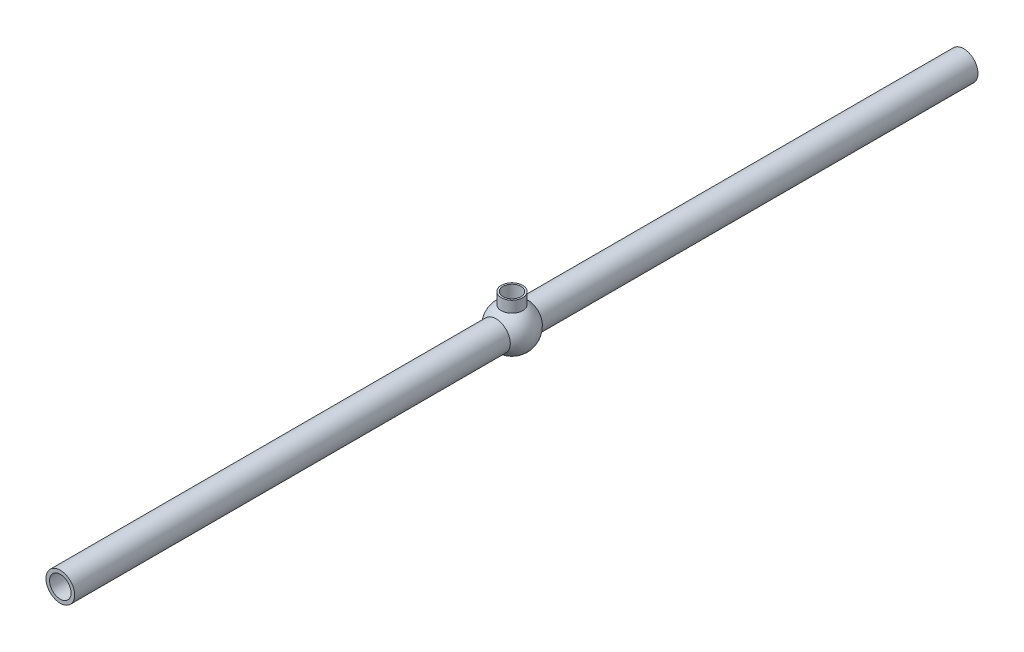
SolidWorks part; units mm, degrees
ref_plane "Front Plane" through (0, 0, 0) normal (0, 0, 1) x (1, 0, 0)
ref_plane "Top Plane" through (0, 0, 0) normal (0, 1, 0) x (1, 0, 0)
ref_plane "Right Plane" through (0, 0, 0) normal (1, 0, 0) x (0, 0, -1)
sketch "Sketch1" plane through (0, 0, 0) normal (0, 0, 1) x (1, 0, 0)
  line L0 (0, 42.0068) -> (0, -30) construction
  line L1 (0, -25) -> (0, -30)
  line L2 (12.5, 21.6506) -> (12.5, 41.6506)
  line L3 (15, 25.9808) -> (15, 41.6506)
  line L4 (15, 41.6506) -> (12.5, 41.6506)
  arc A0 (0, -25) -> (12.5, 21.6506) centre (0, 0) ccw
  arc A1 (0, -30) -> (15, 25.9808) centre (0, 0) ccw
  point P7 (0, 0)
revolve "Revolve1" add sketch "Sketch1" angle 360 about L0
sketch "Sketch2" plane through (0, 0, 0) normal (0, 0, 1) x (1, 0, 0)
  circle A0 centre (0, 0) radius 15
extrude "Extrude1" cut sketch "Sketch2" against normal through all and the other way through all
ref_plane "Plane1" through (0, 0, 30) normal (0, 0, 1) x (1, 0, 0)
sketch "Sketch3" plane through (0, 0, 30) normal (0, 0, 1) x (1, 0, 0)
  circle A0 centre (0, 0) radius 15
extrude "Extrude-Thin1" add sketch "Sketch3" along normal blind 600 and the other way up to next thin
ref_plane "Plane2" through (0, 0, -30) normal (0, 0, 1) x (1, 0, 0)
sketch "Sketch4" plane through (0, 0, -30) normal (0, 0, 1) x (1, 0, 0)
  circle A0 centre (0, 0) radius 15
extrude "Extrude-Thin2" add sketch "Sketch4" against normal blind 600 and the other way up to next thin
